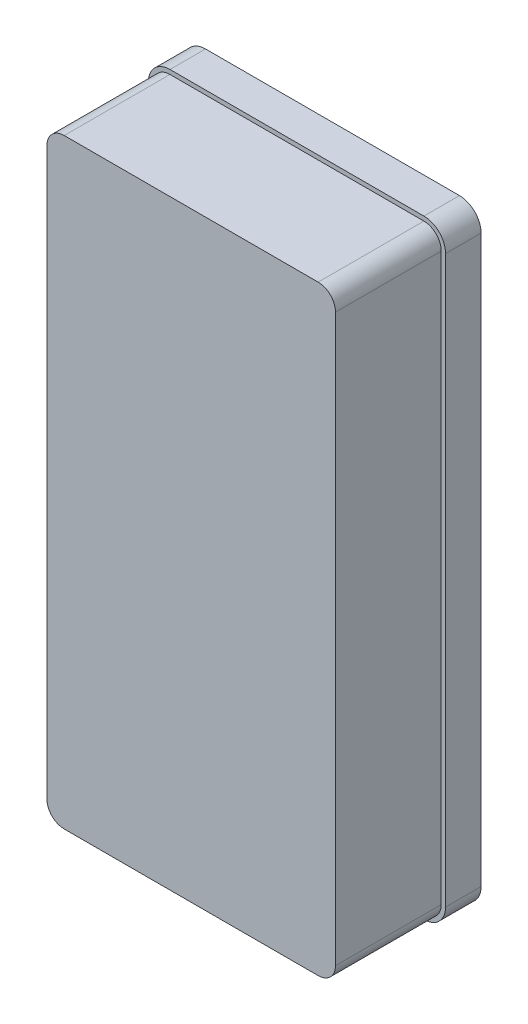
SolidWorks part; units mm, degrees
ref_plane "Plan de face" through (0, 0, 0) normal (0, 0, 1) x (1, 0, 0)
ref_plane "Plan de dessus" through (0, 0, 0) normal (0, 1, 0) x (1, 0, 0)
ref_plane "Plan de droite" through (0, 0, 0) normal (1, 0, 0) x (0, 0, -1)
sketch "Esquisse1" plane through (0, 0, 0) normal (0, 0, 1) x (1, 0, 0)
  line L1 (-14.65, 35.15) -> (14.65, 35.15)
  line L2 (-17.15, 32.65) -> (-17.15, -32.65)
  line L3 (-14.65, -35.15) -> (14.65, -35.15)
  line L4 (17.15, 32.65) -> (17.15, -32.65)
  arc A0 (-14.65, 35.15) -> (-17.15, 32.65) centre (-14.65, 32.65) ccw
  arc A1 (14.65, 35.15) -> (17.15, 32.65) centre (14.65, 32.65) cw
  arc A2 (14.65, -35.15) -> (17.15, -32.65) centre (14.65, -32.65) ccw
  arc A3 (-17.15, -32.65) -> (-14.65, -35.15) centre (-14.65, -32.65) ccw
  point P7 (-17.15, 35.15)
  point P10 (17.15, 35.15)
  point P15 (-17.15, -35.15)
  dimension "D5" = 2.5
  dimension "D1" = 34.3
  dimension "D2" = 70.3
  dimension "D3" = 35.15
  dimension "D4" = 17.15
extrude "Extrusion1" add sketch "Esquisse1" along normal blind 4.1
sketch "Esquisse2" plane through (0, 0, 4.1) normal (0, 0, 1) x (1, 0, 0)
  line L8 (-16.65, 32.65) -> (-16.65, -32.65)
  line L9 (-14.65, -34.65) -> (14.65, -34.65)
  line L10 (16.65, -32.65) -> (16.65, 32.65)
  line L11 (14.65, 34.65) -> (-14.65, 34.65)
  line L12 (-16.65, 32.65) -> (-16.65, -32.65)
  line L13 (-14.65, -34.65) -> (14.65, -34.65)
  line L14 (16.65, -32.65) -> (16.65, 32.65)
  line L15 (14.65, 34.65) -> (-14.65, 34.65)
  arc A4 (-14.65, 34.65) -> (-16.65, 32.65) centre (-14.65, 32.65) ccw
  arc A5 (-14.65, 34.65) -> (-16.65, 32.65) centre (-14.65, 32.65) ccw
  arc A6 (-16.65, -32.65) -> (-14.65, -34.65) centre (-14.65, -32.65) ccw
  arc A7 (-16.65, -32.65) -> (-14.65, -34.65) centre (-14.65, -32.65) ccw
  arc A8 (14.65, -34.65) -> (16.65, -32.65) centre (14.65, -32.65) ccw
  arc A9 (14.65, -34.65) -> (16.65, -32.65) centre (14.65, -32.65) ccw
  arc A10 (16.65, 32.65) -> (14.65, 34.65) centre (14.65, 32.65) ccw
  arc A11 (16.65, 32.65) -> (14.65, 34.65) centre (14.65, 32.65) ccw
  dimension "D1" = 0.5
extrude "Extrusion2" add sketch "Esquisse2" along normal blind 12.2
